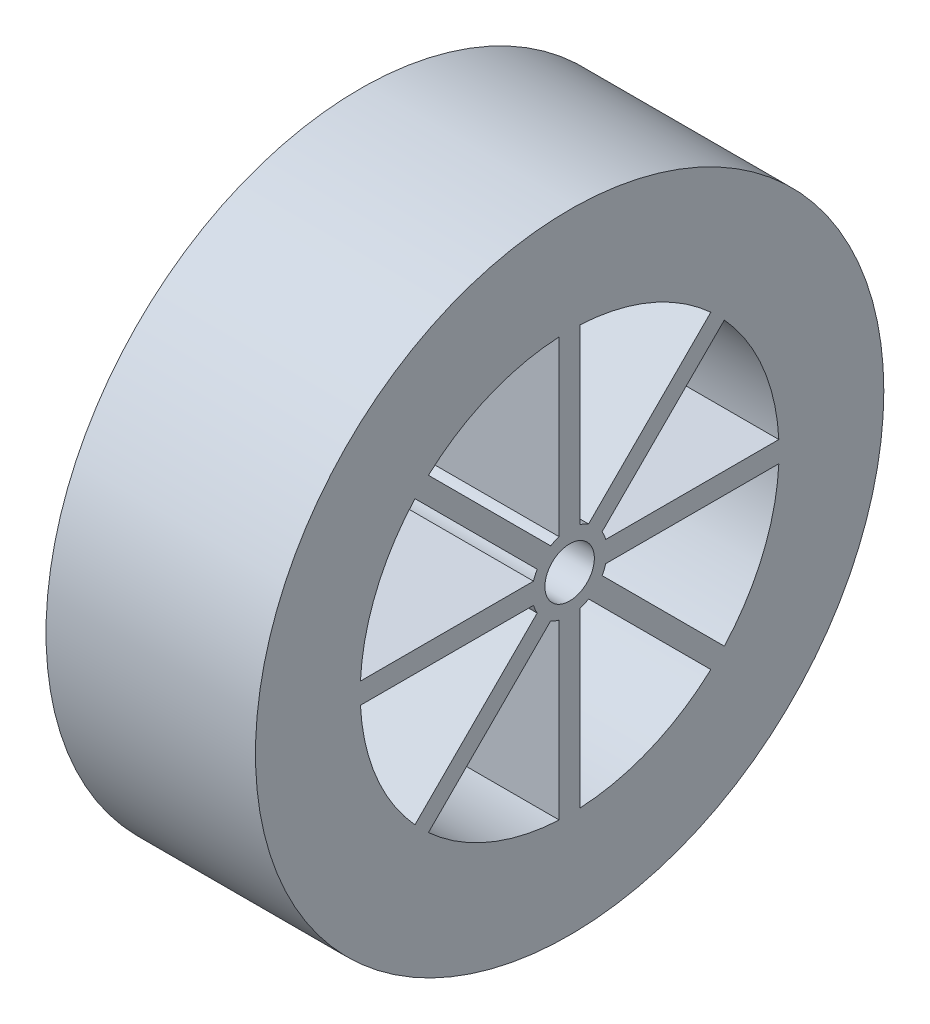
SolidWorks part; units mm, degrees
ref_plane "Front Plane" through (0, 0, 0) normal (0, 0, 1) x (1, 0, 0)
ref_plane "Top Plane" through (0, 0, 0) normal (0, 1, 0) x (1, 0, 0)
ref_plane "Right Plane" through (0, 0, 0) normal (1, 0, 0) x (0, 0, -1)
sketch "Sketch1" plane through (0, 0, 0) normal (1, 0, 0) x (0, 0, -1)
  line L6 (1.1495, 1.9695) -> (8.5609, 9.3809)
  line L8 (-0.635, -12.6841) -> (-0.635, -2.1902)
  line L10 (0.635, -12.6841) -> (0.635, -2.1902)
  line L11 (-0.0318, -0.635) -> (0.0318, -0.635)
  line L12 (0.635, 2.1902) -> (0.635, 12.6841)
  line L13 (-12.6841, 0.635) -> (-2.1902, 0.635)
  line L15 (-12.6841, -0.635) -> (-2.1902, -0.635)
  line L19 (1.9683, 1.1516) -> (9.3793, 8.5626)
  line L20 (-1.1495, 1.9695) -> (-8.5609, 9.3809)
  line L21 (-1.9683, 1.1516) -> (-9.3793, 8.5626)
  line L22 (-1.9683, -1.1516) -> (-9.3793, -8.5626)
  line L23 (-1.1495, -1.9695) -> (-8.5609, -9.3809)
  line L24 (1.1495, -1.9695) -> (8.5609, -9.3809)
  line L25 (1.9683, -1.1516) -> (9.3793, -8.5626)
  line L27 (0.635, -0.0318) -> (0.635, 0)
  line L30 (-0.635, 2.1902) -> (-0.635, 12.6841)
  line L37 (2.1902, 0.635) -> (12.6841, 0.635)
  line L38 (2.1902, -0.635) -> (12.6841, -0.635)
  arc A0 (-9.3793, 8.5626) -> (-12.6841, 0.635) centre (0, 0) ccw
  circle A1 centre (0, 0) radius 19.05
  arc A3 (-12.6841, -0.635) -> (-9.3793, -8.5626) centre (0, 0) ccw
  arc A4 (-0.635, 12.6841) -> (-8.5609, 9.3809) centre (0, 0) ccw
  arc A5 (12.6841, 0.635) -> (9.3793, 8.5626) centre (0, 0) ccw
  arc A6 (0.635, -12.6841) -> (8.5609, -9.3809) centre (0, 0) ccw
  circle A7 centre (0, 0) radius 2.2804
  arc A10 (9.3793, -8.5626) -> (12.6841, -0.635) centre (0, 0) ccw
  arc A12 (-8.5609, -9.3809) -> (-0.635, -12.6841) centre (0, 0) ccw
  arc A13 (8.5609, 9.3809) -> (0.635, 12.6841) centre (0, 0) ccw
  dimension "D1" = 25.4
  dimension "D2" = 38.1
  dimension "D3" = 4.5609
  dimension "D5" = 1.27
  dimension "D6" = 1.27
  dimension "D7" = 45
extrude "Boss-Extrude1" add sketch "Sketch1" along normal blind 12.7
sketch "Sketch2" plane through (12.7, 0, 0) normal (1, 0, 0) x (0, 0, -1)
  circle A0 centre (0, 0) radius 1.5
  dimension "D1" = 3
extrude "Cut-Extrude1" cut sketch "Sketch2" against normal blind 25.4
